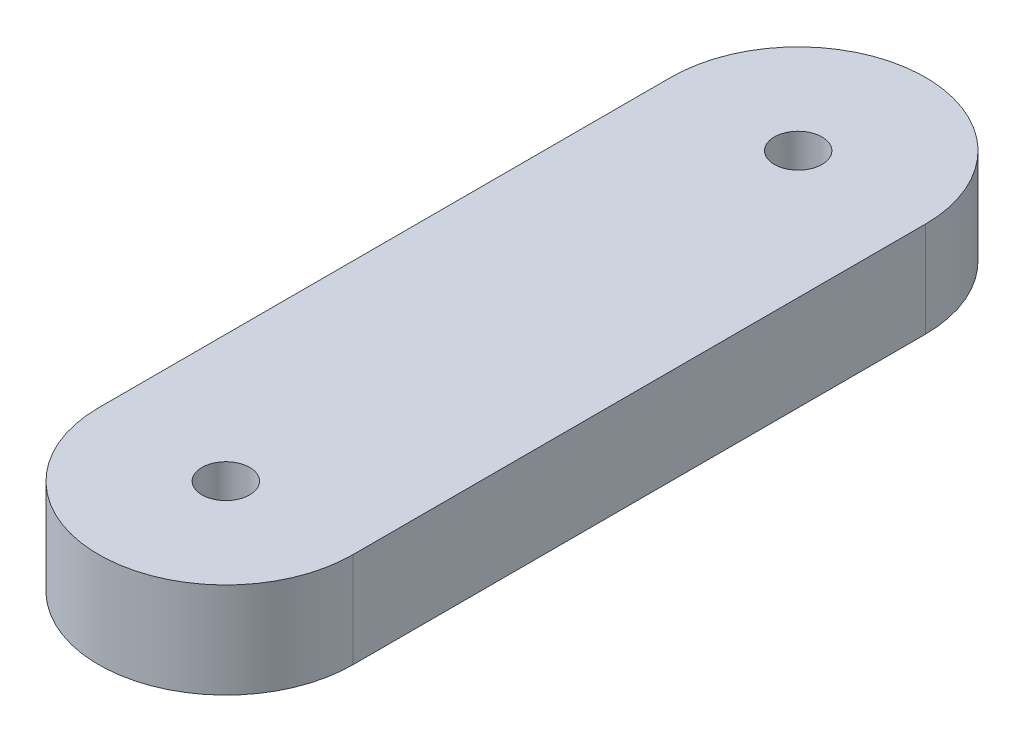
SolidWorks part; units mm, degrees
ref_plane "Спереди" through (0, 0, 0) normal (0, 0, 1) x (1, 0, 0)
ref_plane "Сверху" through (0, 0, 0) normal (0, 1, 0) x (1, 0, 0)
ref_plane "Справа" through (0, 0, 0) normal (1, 0, 0) x (0, 0, -1)
sketch "Эскиз1" plane through (0, 0, 0) normal (0, -1, 0) x (1, 0, 0)
  line L0 (8, -18) -> (8, 18)
  line L1 (-8, 18) -> (-8, -18)
  arc A0 (-8, -18) -> (8, -18) centre (0, -18) ccw
  arc A1 (8, 18) -> (-8, 18) centre (0, 18) ccw
  circle A2 centre (0, -18) radius 1.5
  circle A3 centre (0, 18) radius 1.5
extrude "Бобышка-Вытянуть1" add sketch "Эскиз1" against normal blind 6
